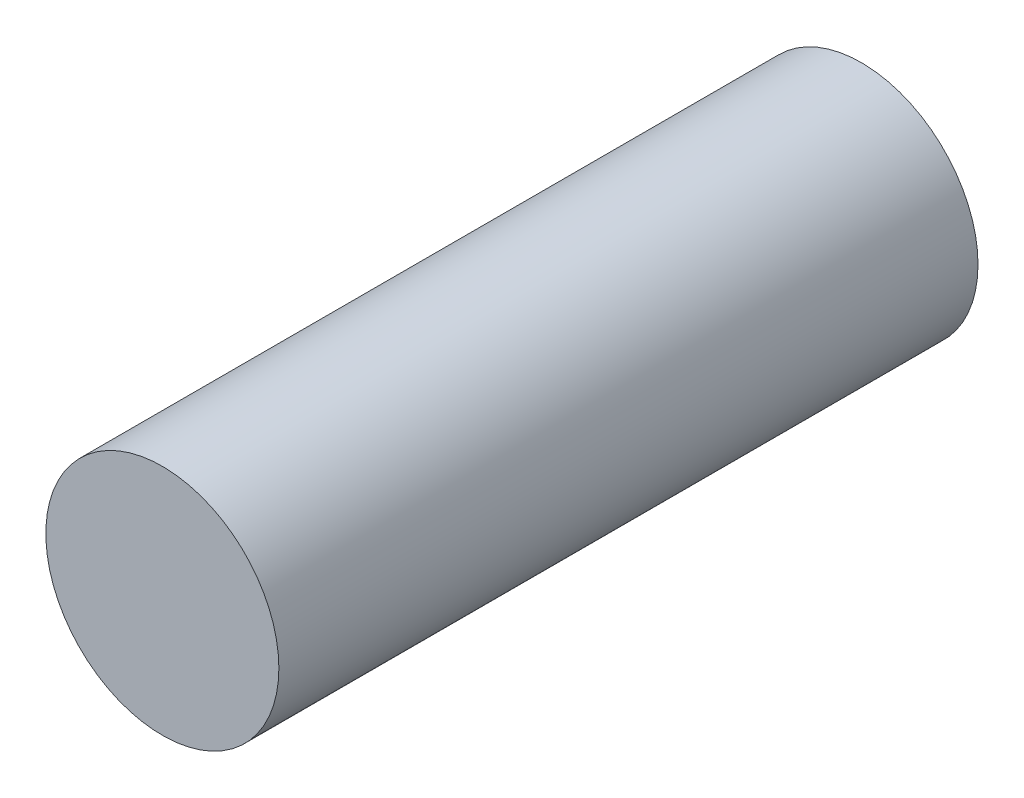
SolidWorks part; units mm, degrees
ref_plane "Plan1" through (0, 0, 0) normal (0, 0, 1) x (1, 0, 0)
ref_plane "Plan2" through (0, 0, 0) normal (0, 1, 0) x (1, 0, 0)
ref_plane "Plan3" through (0, 0, 0) normal (1, 0, 0) x (0, 0, -1)
sketch "Esquisse1" plane through (0, 0, 0) normal (0, 0, 1) x (1, 0, 0)
  circle A0 centre (0, 0) radius 2.5
  dimension "D1" = 5
extrude "BaseExtrusion" add sketch "Esquisse1" along normal blind 15
sketch "Esquisse2" [suppressed] plane through (0, 0, 15) normal (0, 0, 1) x (1, 0, 0)
  circle A1 centre (0, 0) radius 2.5
  circle A2 centre (0, 0) radius 2.5
  dimension "D1" = 0
extrude "Enlèv. mat.-Extru.1" [suppressed] cut sketch "Esquisse2" against normal offset from surface (10.5 mm away) 4.5
